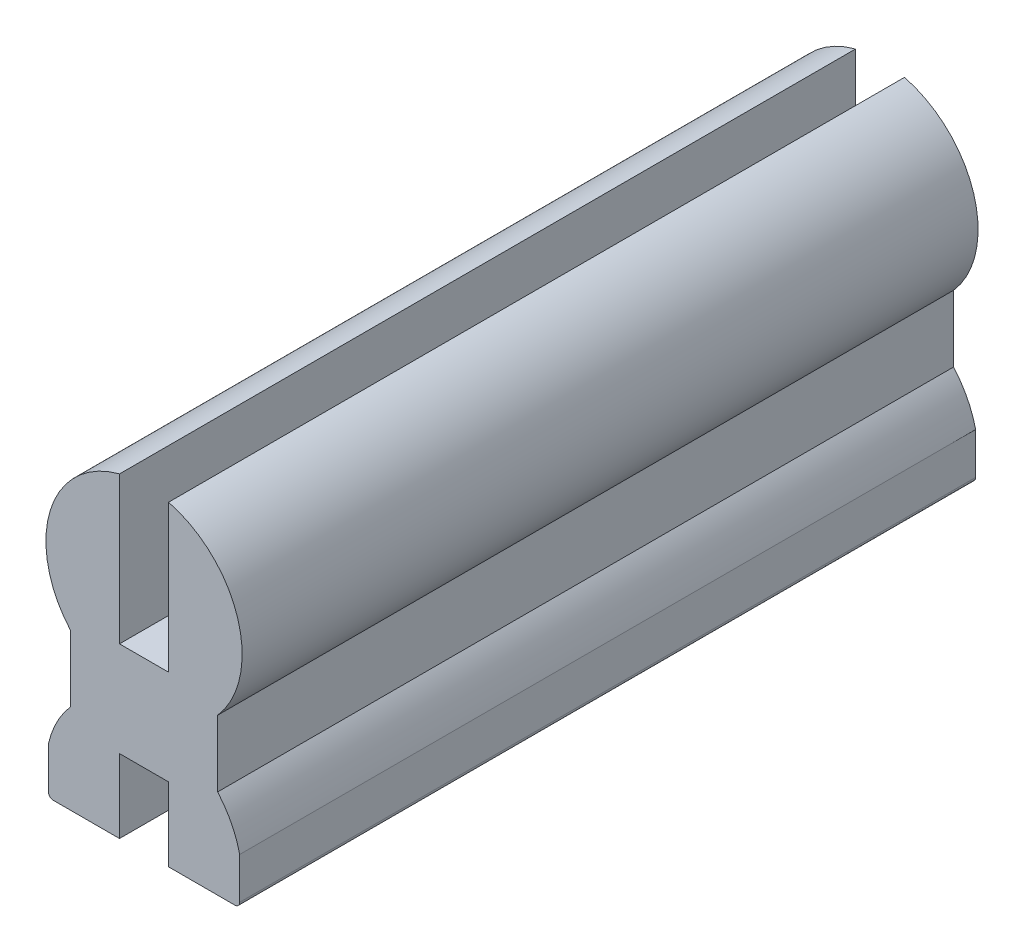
SolidWorks part; units mm, degrees
ref_plane "前视基准面" through (0, 0, 0) normal (0, 0, 1) x (1, 0, 0)
ref_plane "上视基准面" through (0, 0, 0) normal (0, 1, 0) x (1, 0, 0)
ref_plane "右视基准面" through (0, 0, 0) normal (1, 0, 0) x (0, 0, -1)
sketch "草图1" plane through (0, 0, 0) normal (0, 0, 1) x (1, 0, 0)
  line L0 (-1.95, -2.5) -> (-0.5, -2.5)
  line L1 (-0.5, 3.9365) -> (-0.5, 0.9365)
  line L2 (-1.5, 0.6771) -> (-1.5, -0.6771)
  line L3 (0.5, 0.9365) -> (0.5, 3.9365)
  line L4 (1.5, 0.6771) -> (1.5, -0.6771)
  line L5 (-1.95, -2.5) -> (-1.95, -1.5556)
  line L6 (1.95, -2.5) -> (1.95, -1.5556)
  line L7 (-0.5, -1) -> (0.5, -1)
  line L9 (-0.5, -1) -> (-0.5, -2.5)
  line L10 (0.5, -1) -> (0.5, -2.5)
  line L11 (0.5, -2.5) -> (1.95, -2.5)
  line L13 (-0.5, 0.9365) -> (0.5, 0.9365)
  arc A0 (1.95, -1.5556) -> (1.5, -0.6771) centre (0, -2) ccw
  arc A1 (-1.5, -0.6771) -> (-1.95, -1.5556) centre (0, -2) ccw
  arc A2 (1.5, 0.6771) -> (0.5, 3.9365) centre (0, 2) ccw
  arc A3 (-0.5, 3.9365) -> (-1.5, 0.6771) centre (0, 2) ccw
extrude "凸台-拉伸1" add sketch "草图1" against normal blind 15
fillet "圆角1" radius 0.1 2 edges at (-1.95, -2.5, -7.5) (1.95, -2.5, -7.5)
